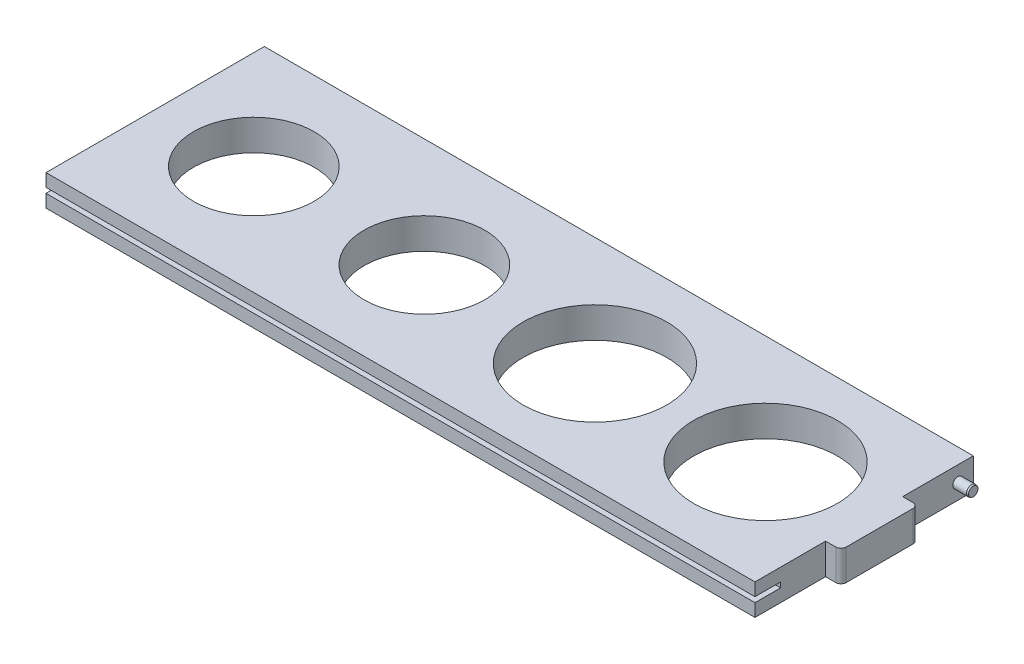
SolidWorks part; units mm, degrees
ref_plane "Front Plane" through (0, 0, 0) normal (0, 0, 1) x (1, 0, 0)
ref_plane "Top Plane" through (0, 0, 0) normal (0, 1, 0) x (1, 0, 0)
ref_plane "Right Plane" through (0, 0, 0) normal (1, 0, 0) x (0, 0, -1)
body saved out of another part "Stock-Donut Shop-1"
hole_wizard "CBORE for M4 Pan Head Machine Screw" positions "3DSketch1" profile "Sketch1" counterbore size "M4" standard "ANSI Metric"
sketch3d "3DSketch1"
  point P0 (-240, 216, -84)
  point P3 (-240, 47, -99)
  point P6 (-240, 6, -99)
  point P9 (-240, 47, 99)
  point P12 (-240, 6, 99)
sketch "Sketch1" plane through (-240, 216, -84) normal (0, 1, 0) x (0, 0, 1)
  line L0 (0, 0) -> (0, 30)
  line L1 (0, 30) -> (2.25, 28.6481)
  line L2 (2.25, 28.6481) -> (2.25, 3.1)
  line L3 (2.25, 3.1) -> (4.5, 3.1)
  line L4 (4.5, 3.1) -> (4.5, 0)
  line L5 (4.5, 0) -> (0, 0)
  line L6 (0, 30) -> (-2.25, 28.6481) construction
  line L7 (0, -6.35) -> (0, 107.95) construction
  dimension "Hole Dia." = 4.5
  dimension "Hole Depth" = 30
  dimension "C'Bore Dia." = 9
  dimension "C'Bore Depth" = 3.1
  dimension "Drill Angle" = 118
hole_wizard "Ø4.0mm Dowel Hole1" positions "3DSketch2" profile "Sketch2" hole size "Ø4.0" standard "ANSI Metric"
sketch3d "3DSketch2"
  point P0 (48, 47, -99)
  point P4 (48, 47, 99)
  point P8 (48, 216, -84)
  point P11 (48, 24, -99)
  point P14 (48, 24, 99)
sketch "Sketch2" plane through (48, 47, -99) normal (0, 1, 0) x (0, 0, -1)
  line L0 (0, 0) -> (0, 14)
  line L1 (0, 14) -> (2, 14)
  line L2 (2, 14) -> (2, 0)
  line L3 (2, 0) -> (0, 0)
  line L4 (0, 14) -> (-2, 14) construction
  line L5 (0, -6.35) -> (0, 107.95) construction
  dimension "Hole Dia." = 4
  dimension "Hole Depth" = 14
  dimension "Drill Angle" = 180
inserted part "parallel pin hardened_bsi"
move or copy body "Body-Move/Copy2" placed by mates yes
